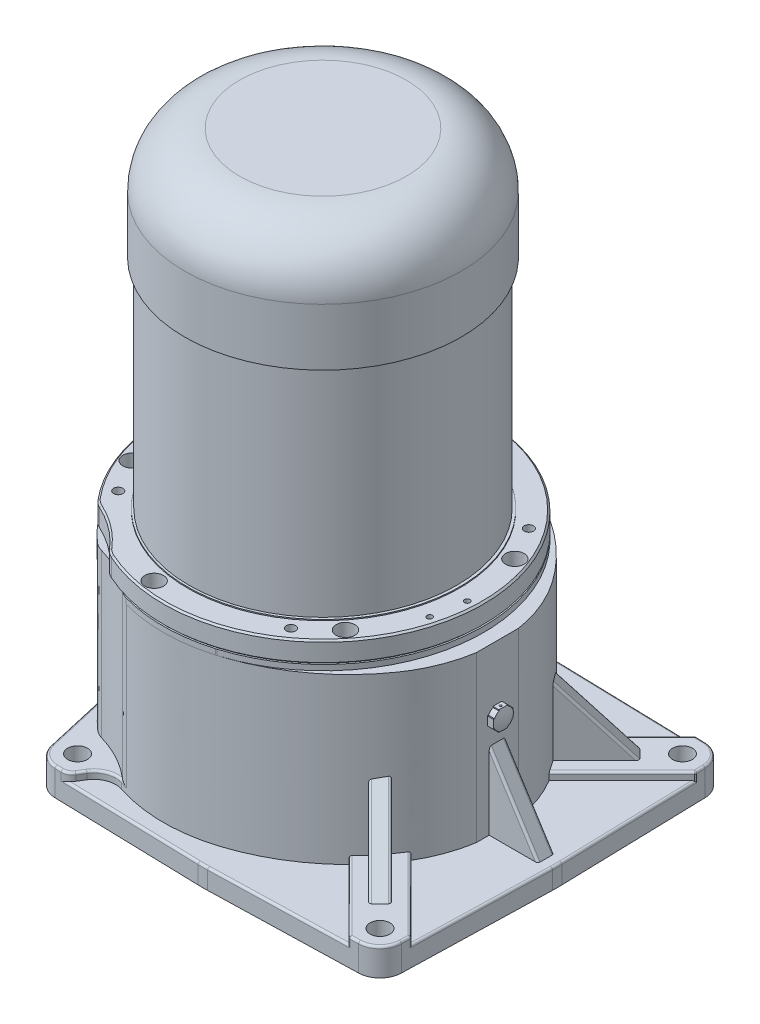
SolidWorks part; units mm, degrees
ref_plane "前视基准面" through (0, 0, 0) normal (0, 0, 1) x (1, 0, 0)
ref_plane "上视基准面" through (0, 0, 0) normal (0, 1, 0) x (1, 0, 0)
ref_plane "右视基准面" through (0, 0, 0) normal (1, 0, 0) x (0, 0, -1)
imported_body "50箱盖-1-surface1"
imported_body "复件 5034.2200.106-00-1-surface1"
imported_body "复件 5034.2200.106-00-1-surface2"
imported_body "复件 5034.2200.106-00-1-surface3"
imported_body "复件 5034.2200.106-00-1-surface4"
imported_body "复件 5034.2200.106-00-1-surface5"
imported_body "复件 5034.2200.106-00-1-surface6"
imported_body "复件 5034.2200.106-00-1-surface7"
imported_body "复件 5034.2200.106-00-1-surface8"
imported_body "复件 5034.2200.106-00-1-surface9"
imported_body "复件 5034.2200.106-00-1-surface10"
imported_body "复件 5034.2200.106-00-1-surface11"
imported_body "复件 5034.2200.106-00-1-surface13"
imported_body "复件 5034.2200.106-00-1-surface14"
imported_body "复件 5034.2200.106-00-1-surface15"
imported_body "复件 5034.2200.106-00-1-surface16"
imported_body "复件 5034.2200.106-00-1-surface17"
imported_body "复件 5034.2200.106-00-1-surface18"
imported_body "复件 5034.2200.106-00-1-surface19"
imported_body "复件 5034.2200.106-00-1-surface20"
imported_body "复件 5034.2200.106-00-1-surface21"
imported_body "复件 5034.2200.106-00-1-surface22"
imported_body "复件 5034.2200.106-00-1-surface23"
imported_body "复件 5034.2200.106-00-1-surface24"
imported_body "复件 5034.2200.106-00-1-surface25"
imported_body "复件 5034.2200.106-00-1-surface26"
imported_body "复件 5034.2200.106-00-1-surface27"
imported_body "复件 5034.2200.106-00-1-surface28"
imported_body "复件 5034.2200.106-00-1-surface29"
imported_body "复件 5034.2200.106-00-1-surface30"
imported_body "复件 5034.2200.106-00-1-surface31"
imported_body "复件 5034.2200.106-00-1-surface32"
imported_body "复件 5034.2200.106-00-1-surface33"
imported_body "复件 5034.2200.106-00-1-surface34"
imported_body "复件 5034.2200.106-00-1-surface35"
imported_body "复件 5034.2200.106-00-1-surface36"
imported_body "复件 5034.2200.106-00-1-surface37"
imported_body "复件 5034.2200.106-00-1-surface38"
imported_body "复件 5034.2200.106-00-1-surface39"
imported_body "复件 5034.2200.106-00-1-surface40"
imported_body "复件 5034.2200.106-00-1-surface41"
imported_body "复件 5034.2200.106-00-1-surface42"
imported_body "复件 5034.2200.106-00-1-surface43"
imported_body "复件 5034.2200.106-00-1-surface44"
imported_body "复件 5034.2200.106-00-1-surface45"
imported_body "复件 5034.2200.106-00-1-surface46"
imported_body "复件 5034.2200.106-00-1-surface47"
imported_body "复件 5034.2200.106-00-1-surface48"
imported_body "复件 5034.2200.106-00-1-surface49"
imported_body "复件 5034.2200.106-00-1-surface50"
imported_body "复件 5034.2200.106-00-1-surface51"
imported_body "复件 5034.2200.106-00-1-surface52"
imported_body "复件 5034.2200.106-00-1-surface53"
imported_body "复件 5034.2200.106-00-1-surface54"
imported_body "复件 5034.2200.106-00-1-surface55"
imported_body "复件 5034.2200.106-00-1-surface56"
imported_body "复件 5034.2200.106-00-1-surface57"
imported_body "复件 5034.2200.106-00-1-surface58"
imported_body "立式箱体-2-surface1"
imported_body "立式箱体-2-surface2"
imported_body "立式箱体-2-surface3"
imported_body "透气塞-1-surface1"
sketch "草图3" plane through (0, -196.7551, 0) normal (0, 1, 0) x (1, 0, 0)
  circle A0 centre (15.5509, 127.454) radius 122
  circle A1 centre (67.5509, 127.454) radius 52 construction
extrude "凸台-拉伸1" add sketch "草图3" along normal blind 199
sketch "草图4" plane through (0, 2.2449, 0) normal (0, 1, 0) x (1, 0, 0)
  circle A0 centre (15.5509, 127.454) radius 126
extrude "凸台-拉伸2" add sketch "草图4" along normal blind 102
fillet "圆角1" radius 50 1 edges at (15.5509, 104.2449, -1.454)
